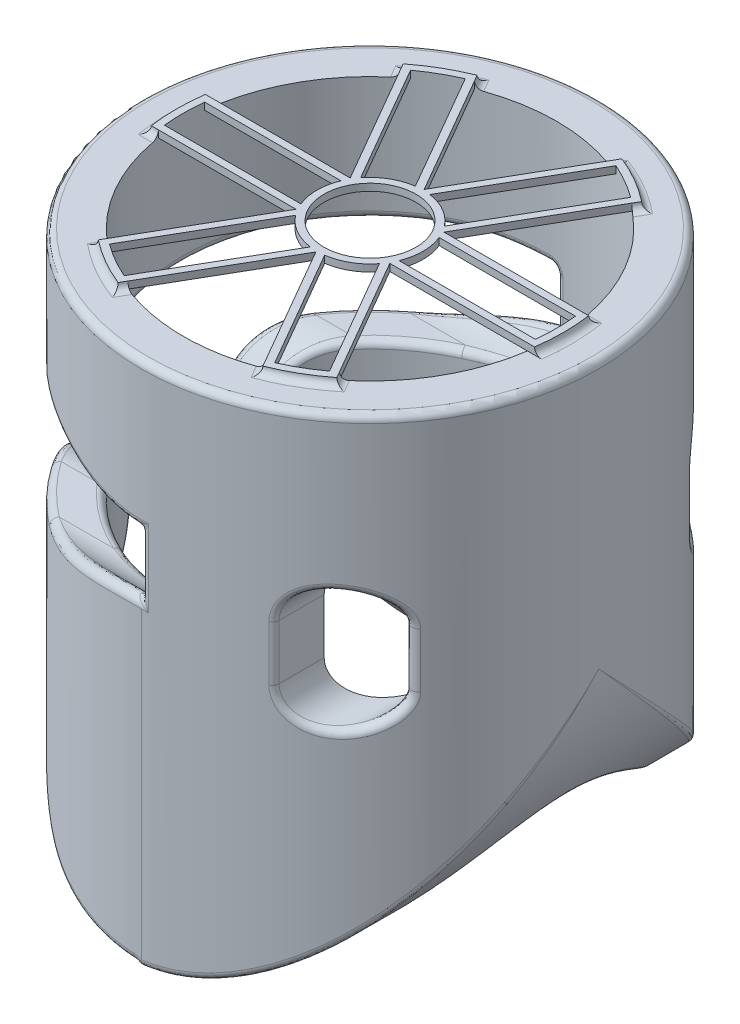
SolidWorks part; units mm, degrees
ref_plane "Front Plane" through (0, 0, 0) normal (0, 0, 1) x (1, 0, 0)
ref_plane "Top Plane" through (0, 0, 0) normal (0, 1, 0) x (1, 0, 0)
ref_plane "Right Plane" through (0, 0, 0) normal (1, 0, 0) x (0, 0, -1)
sketch "Sketch1" plane through (0, 0, 0) normal (0, 1, 0) x (1, 0, 0)
  circle A0 centre (0, 0) radius 82.55
  circle A1 centre (0, 0) radius 31.75
  dimension "D1" = 165.1
  dimension "D2" = 63.5
extrude "Boss-Extrude1" add sketch "Sketch1" against normal blind 190.5
shell "Shell1" thickness 15.24
sketch "Sketch2" plane through (0, 0, 0) normal (1, 0, 0) x (0, 0, -1)
  line L0 (82.55, -190.5) -> (82.55, 0) construction
  line L1 (-82.55, -190.5) -> (82.55, -190.5) construction
  line L2 (-82.55, 0) -> (-82.55, -190.5) construction
  line L3 (82.55, -190.5) -> (82.55, 0)
  line L4 (-82.55, -190.5) -> (82.55, -190.5)
  line L5 (-82.55, 0) -> (-82.55, -190.5)
  line L6 (-63.5, -44.5331) -> (63.5, -44.5331)
  line L7 (45.9933, -82.6331) -> (63.5, -82.6331)
  line L9 (-63.5, -82.6331) -> (-45.8276, -82.6331)
  arc A0 (-63.5, -44.5331) -> (-63.5, -82.6331) centre (-63.5, -63.5831) ccw
  arc A1 (63.5, -82.6331) -> (63.5, -44.5331) centre (63.5, -63.5831) ccw
  circle A4 centre (45.9933, -105.4931) radius 22.86
  arc A5 (-45.8276, -128.3531) -> (-82.55, -190.5) centre (-105.5168, -135.006) cw
  circle A6 centre (-45.8276, -105.4931) radius 22.86
  arc A8 (45.9933, -128.3531) -> (82.55, -190.5) centre (105.6751, -135.0718) ccw
  point P16 (0, 0)
  dimension "D1" = 38.1
  dimension "D2" = 45.72
  dimension "D3" = 127
extrude "Cut-Extrude12" cut sketch "Sketch2" against normal blind 203.2 contours A8 A4 L7 A1 L6 A0 L9 A6 A5 L4
sketch "Sketch5" plane through (0, 0, 0) normal (0, 0, 1) x (1, 0, 0)
  line L0 (0, -190.5) -> (-11.6325, -190.5)
  line L1 (0, -190.5) -> (82.55, -190.5) construction
  line L2 (82.55, 0) -> (-82.55, 0) construction
  line L3 (82.55, -190.5) -> (82.55, 0) construction
  line L4 (0, -190.5) -> (82.55, -190.5)
  line L5 (82.55, 0) -> (-82.55, 0)
  line L6 (82.55, -190.5) -> (82.55, 0)
  arc A0 (-11.6325, -190.5) -> (82.55, -96.3175) centre (-11.6325, -96.3175) ccw
extrude "Cut-Extrude13" cut sketch "Sketch5" against normal through all and the other way through all contours A0 L0 L4 L6
sketch "Sketch7" plane through (0, 0, 0) normal (0, 1, 0) x (1, 0, 0)
  line L0 (0, 12.4565) -> (0, -12.4565)
  line L1 (-17.7181, 7.2311) -> (-66.9205, 7.2311)
  line L3 (-17.7181, -7.2311) -> (-66.9205, -7.2311)
  line L5 (-17.7181, 7.2311) -> (-66.9205, -7.2311) construction
  line L6 (-17.7181, -7.2311) -> (-66.9205, 7.2311) construction
  line L7 (17.7181, -7.2311) -> (66.9205, -7.2311)
  line L8 (17.7181, 7.2311) -> (66.9205, 7.2311)
  line L9 (-12.4565, 0) -> (12.4565, 0)
  line L10 (6.2283, 10.7877) -> (-6.2283, -10.7877) construction
  line L11 (-6.2283, 10.7877) -> (6.2283, -10.7877) construction
  line L12 (2.5968, -18.9599) -> (27.1979, -61.5704)
  line L13 (15.1214, -11.7288) -> (39.7225, -54.3393)
  line L14 (15.1214, 11.7288) -> (39.7225, 54.3393)
  line L15 (2.5968, 18.9599) -> (27.1979, 61.5704)
  line L16 (-2.5968, -18.9599) -> (-27.1979, -61.5704)
  line L17 (-15.1214, -11.7288) -> (-39.7225, -54.3393)
  line L18 (-17.7181, -7.2311) -> (-66.9205, -7.2311)
  line L19 (-17.7181, 7.2311) -> (-66.9205, 7.2311)
  line L20 (-15.1214, 11.7288) -> (-39.7225, 54.3393)
  line L21 (-2.5968, 18.9599) -> (-27.1979, 61.5704)
  circle A0 centre (0, 0) radius 19.1369
  circle A1 centre (0, 0) radius 12.4565
  circle A2 centre (0, 0) radius 67.31
  circle A3 centre (0, 0) radius 67.31 construction
  point P4 (-42.3193, 0)
  dimension "D1" = 24.9131
  dimension "D2" = 38.2738
  dimension "D3" = 49.2023
  dimension "D4" = 60
  dimension "D5" = 60
  dimension "D6" = 14.4622
extrude "Extrude-Thin2" add sketch "Sketch7" along normal blind 2.54 thin contours L1 A2 L3 A0 | L17 A2 L16 A0 | L12 A2 L13 A0 | L7 A2 L8 A0 | L14 A2 L15 A0 | L21 A2 L20 A0
fillet "Fillet1" radius 2.54 3 edges at (-69.1632, 1.27, 9.7711) (-69.85, 0, 0) (-69.1632, 1.27, -9.7711)
fillet "Fillet2" radius 2.54 3 edges at (-26.1196, 1.27, 64.7826) (-34.925, 0, 60.4919) (-43.0436, 1.27, 55.0115)
fillet "Fillet3" radius 2.54 3 edges at (43.0436, 1.27, 55.0115) (34.925, 0, 60.4919) (26.1196, 1.27, 64.7826)
fillet "Fillet4" radius 2.54 3 edges at (69.1632, 1.27, -9.7711) (69.85, 0, 0) (69.1632, 1.27, 9.7711)
fillet "Fillet5" radius 2.54 3 edges at (26.1196, 1.27, -64.7826) (34.925, 0, -60.4919) (43.0436, 1.27, -55.0115)
fillet "Fillet6" radius 2.54 3 edges at (-43.0436, 1.27, -55.0115) (-34.925, 0, -60.4919) (-26.1196, 1.27, -64.7826)
sketch "Sketch8" plane through (0, 0, 0) normal (0, 0, 1) x (1, 0, 0)
  line L2 (62.2027, -67.3896) -> (62.2027, -87.1665)
  line L4 (38.6044, -67.3896) -> (38.6044, -87.1665)
  line L5 (50.4036, -77.278) -> (38.6044, -87.1665) construction
  line L6 (50.4036, -77.278) -> (38.6044, -67.3896) construction
  arc A0 (38.6044, -67.3896) -> (62.2027, -67.3896) centre (50.4036, -67.3896) cw
  arc A1 (38.6044, -87.1665) -> (62.2027, -87.1665) centre (50.4036, -87.1665) ccw
  point P0 (50.4036, -77.278)
  dimension "D2" = 11.7991
  dimension "D1" = 19.7768
extrude "Cut-Extrude14" cut sketch "Sketch8" against normal through all and the other way through all
move or copy body "Body-Convert to Mesh Body2" [suppressed] bodies to move or copy 119 copy no translate (0, 0, 0)
fillet "Fillet7" radius 2.54 4 edges at (49.9285, -98.956, 65.7393) (38.6044, -77.278, 72.9671) (49.187, -55.6534, 66.2959) (62.2027, -77.278, 54.2709)
fillet "Fillet8" radius 2.54 4 edges at (49.9285, -55.6001, -65.7393) (38.6044, -77.278, -72.9671) (49.187, -98.9027, -66.2959) (62.2027, -77.278, -54.2709)
fillet "Fillet9" radius 2.54 3 edges at (-39.8301, -46.6903, -72.3054) (-39.8301, -46.6903, 72.3054) (-82.55, -44.5331, 0)
fillet "Fillet11" radius 2.54 3 edges at (-79.1641, -102.0131, -23.3997) (-61.277, -82.6331, -55.3139) (-39.8301, -80.4759, -72.3054)
fillet "Fillet12" radius 2.54 1 edges at (0, -63.5831, -82.55)
fillet "Fillet13" radius 2.54 14 edges at (-19.05, -44.5625, 64.558) (-63.1376, -102.5029, -23.3297) (-67.31, -44.5331, 0) (-36.7914, -82.6331, -56.3652) (-3.4401, -44.9003, -67.222) (-6.8092, -76.1562, -77.8115) (-19.05, -82.6037, -64.558) (0.3254, -75.2596, -81.2135) (0.3254, -51.9066, -81.2135) (0, -47.2044, -73.2284) (0, -79.9618, -73.2284) (0, -63.5831, -67.31) (0, -75.2007, -78.9207) (0, -51.9655, -78.9207)
fillet "Fillet14" radius 2.54 3 edges at (-3.4401, -82.266, 67.222) (-36.8862, -82.6331, 56.3032) (-63.1973, -108.5095, 23.1675)
fillet "Fillet15" radius 2.54 3 edges at (-39.8301, -80.4759, 72.3054) (-61.3438, -82.6331, 55.2399) (-79.2138, -108.9538, 23.2311)
fillet "Fillet16" radius 2.54 1 edges at (0, -63.5831, 82.55)
fillet "Fillet17" radius 2.54 9 edges at (0.3254, -51.9066, 81.2135) (0.3254, -75.2596, 81.2135) (0, -79.47, 74.0124) (0, -82.7092, 67.8068) (0, -63.5831, 67.31) (0, -44.457, 67.8068) (0, -47.6963, 74.0124) (0, -51.9655, 78.9207) (0, -75.2007, 78.9207)
fillet "Fillet18" radius 2.54 1 edges at (0, 0, 82.55)
fillet "Fillet21" radius 2.54 1 edges at (26.1191, 0, 64.7818)
fillet "Fillet25" radius 2.54 5 edges at (-41.527, -164.0958, 52.9731) (0, -189.7789, 74.0948) (0, -186.0152, 73.8131) (0, -185.5619, 67.31)
fillet "Fillet26" radius 2.54 5 edges at (-41.4111, -164.039, -53.0637) (0, -185.9843, -73.8164) (0, -189.7789, -74.1011) (0, -185.5293, -67.31)
fillet "Fillet27" radius 2.54 3 edges at (0.7116, -188.6206, 68.0407) (0.7116, -188.6206, -68.0407) (67.1991, -147.8531, 3.862)
fillet "Fillet28" radius 2.54 3 edges at (-57.6674, -172.9504, -59.0675) (-6.4854, -190.3194, -82.2948) (30.9228, -180.3377, -76.5394)
fillet "Fillet29" radius 2.54 3 edges at (-57.7427, -172.9886, 58.9939) (-7.4416, -190.3273, 82.2139) (30.9228, -180.3377, 76.5394)
fillet "Fillet30" radius 2.54 2 edges at (-43.0432, 0, -55.0107) (-43.32, 0.9649, -55.4902)
fillet "Fillet31" radius 2.54 2 edges at (-69.1623, 0, -9.7711) (-69.7159, 0.9649, -9.7711)
fillet "Fillet32" radius 2.54 2 edges at (-69.1623, 0, 9.7711) (-69.7159, 0.9649, 9.7711)
fillet "Fillet33" radius 2.54 2 edges at (-26.1191, 0, -64.7818) (-26.396, 0.9649, -65.2613)
fillet "Fillet34" radius 2.54 2 edges at (26.1191, 0, -64.7818) (26.396, 0.9649, -65.2613)
fillet "Fillet35" radius 2.54 2 edges at (43.0432, 0, -55.0107) (43.32, 0.9649, -55.4902)
fillet "Fillet36" radius 2.54 2 edges at (-43.0432, 0, 55.0107) (-43.32, 0.9649, 55.4902)
fillet "Fillet37" radius 2.54 2 edges at (-26.1191, 0, 64.7818) (-26.396, 0.9649, 65.2613)
fillet "Fillet38" radius 2.54 2 edges at (43.0432, 0, 55.0107) (43.32, 0.9649, 55.4902)
fillet "Fillet39" radius 2.54 2 edges at (69.1623, 0, -9.7711) (69.7159, 0.9649, -9.7711)
